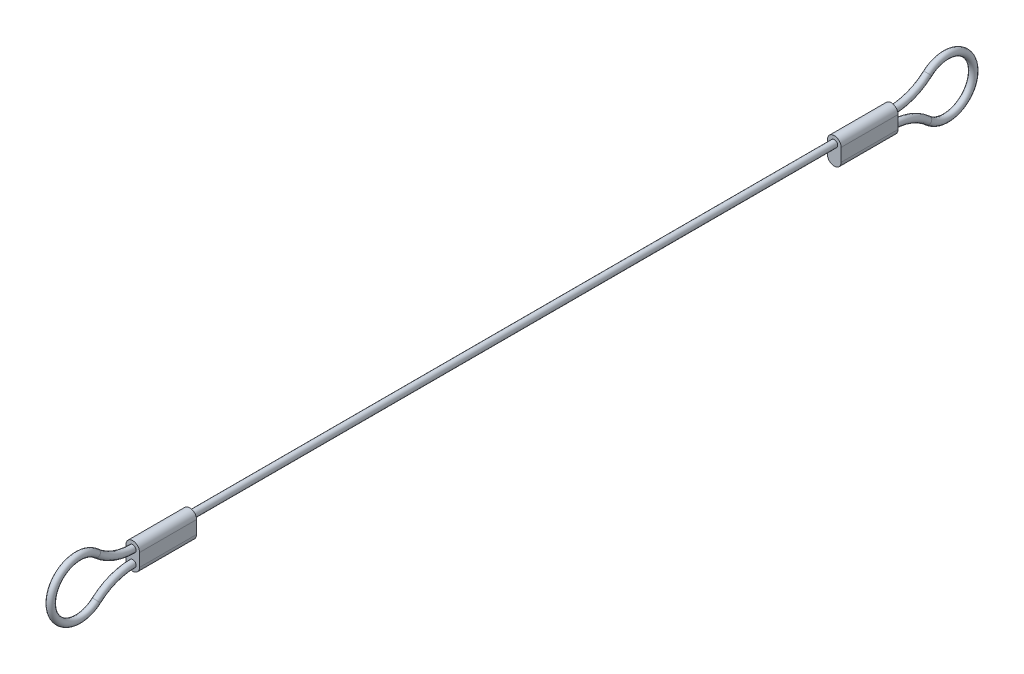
SolidWorks part; units mm, degrees
ref_plane "Front Plane" through (0, 0, 0) normal (0, 0, 1) x (1, 0, 0)
ref_plane "Top Plane" through (0, 0, 0) normal (0, 1, 0) x (1, 0, 0)
ref_plane "Right Plane" through (0, 0, 0) normal (1, 0, 0) x (0, 0, -1)
sketch "Sketch1" plane through (0, 0, 0) normal (1, 0, 0) x (0, 0, -1)
  line L0 (66.6, 0) -> (-66.6, 0)
  line L1 (0, 1.32) -> (0, -1.32) construction
  arc A0 (-66.6, 0) -> (-73, 2.4446) centre (-66.6, 9.6) cw
  arc A1 (-73, 2.4446) -> (-73, -4.7108) centre (-76.2, -1.1331) ccw
  arc A2 (-73, -4.7108) -> (-66.6, -2.2663) centre (-66.6, -11.8663) cw
  arc A3 (73, -4.7108) -> (66.6, -2.2663) centre (66.6, -11.8663) ccw
  arc A4 (73, 2.4446) -> (73, -4.7108) centre (76.2, -1.1331) cw
  arc A5 (66.6, 0) -> (73, 2.4446) centre (66.6, 9.6) ccw
  point P18 (0, 0)
  dimension "D1" = 4.8
  dimension "D4" = 9.6
  dimension "D2" = 76.2
  dimension "D3" = 9.6
sketch "Sketch2" plane through (0, 0, 0) normal (0, 0, 1) x (1, 0, 0)
  circle A0 centre (0, 0) radius 0.595
  dimension "D1" = 1.19
sweep "Sweep1" add profiles "Sketch2" path "Sketch1"
sketch "Sketch3" plane through (0, 0, 66.6) normal (0, 0, -1) x (-1, 0, 0)
  line L0 (0, 0) -> (0, -2.2663) construction
  line L1 (1.2, 0) -> (1.2, -2.2663)
  line L2 (-1.2, 0) -> (-1.2, -2.2663)
  line L3 (-0.595, -2.2663) -> (0.595, -2.2663) construction
  arc A0 (1.2, 0) -> (-1.2, 0) centre (0, 0) ccw
  arc A1 (-1.2, -2.2663) -> (1.2, -2.2663) centre (0, -2.2663) ccw
  point P3 (0, -1.1331)
  dimension "D1" = 2.4
extrude "Boss-Extrude1" add sketch "Sketch3" along normal blind 10
mirror "Mirror1" about plane through (0, 0, 0) normal (0, 0, 1) of "Boss-Extrude1"
